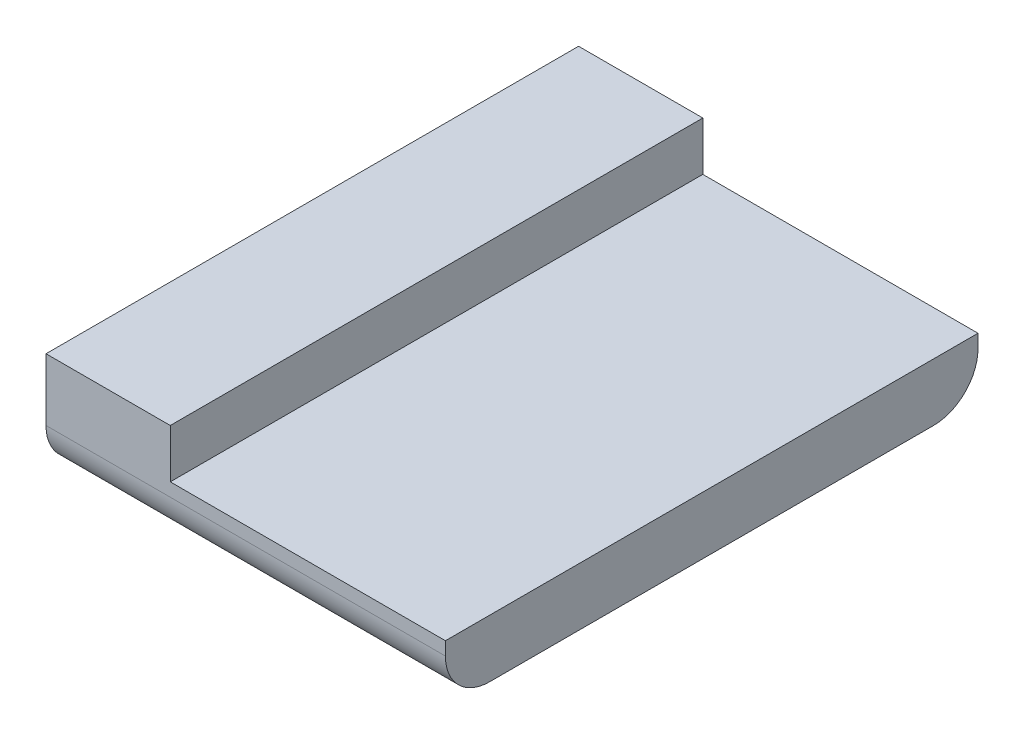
SolidWorks part; units mm, degrees
ref_plane "Ebene vorne" through (0, 0, 0) normal (0, 0, 1) x (1, 0, 0)
ref_plane "Ebene oben" through (0, 0, 0) normal (0, 1, 0) x (1, 0, 0)
ref_plane "Ebene rechts" through (0, 0, 0) normal (1, 0, 0) x (0, 0, -1)
sketch "Skizze1" plane through (0, 0, 0) normal (0, 0, 1) x (1, 0, 0)
  line L0 (14, -5.5) -> (45, -5.5)
  line L1 (0, 0) -> (14, 0)
  line L2 (0, 0) -> (0, -12)
  line L3 (0, -12) -> (45, -12)
  line L4 (45, -5.5) -> (45, -12)
  line L5 (14, 0) -> (14, -5.5)
  dimension "D1" = 12
  dimension "D2" = 45
  dimension "D3" = 31
  dimension "D4" = 6.5
extrude "Linear austragen1" add sketch "Skizze1" along normal blind 60
fillet "Verrundung1" radius 5 2 edges at (22.5, -12, 60) (22.5, -12, 0)
